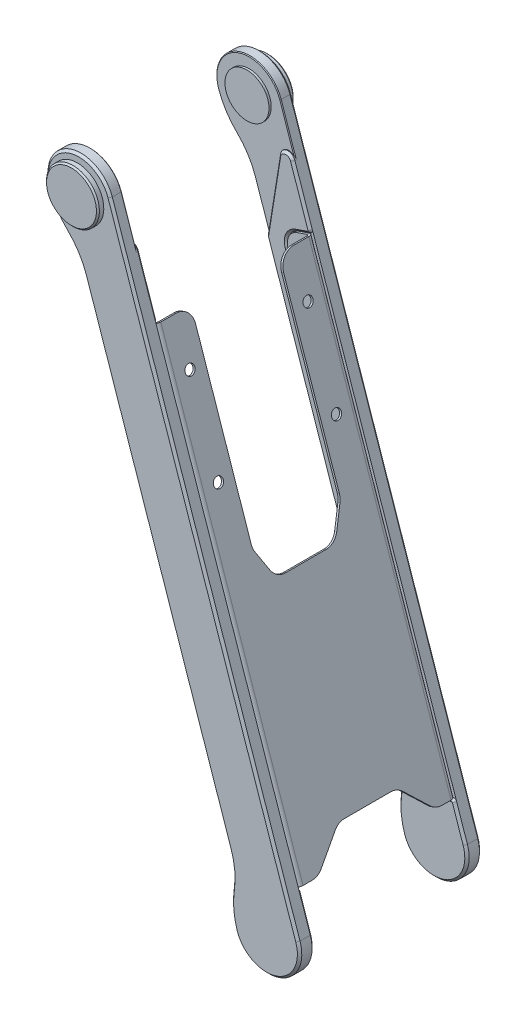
SolidWorks part; units mm, degrees
ref_plane "Front" through (0, 0, 0) normal (0, 0, 1) x (1, 0, 0)
ref_plane "Top" through (0, 0, 0) normal (0, 1, 0) x (1, 0, 0)
ref_plane "Right" through (0, 0, 0) normal (1, 0, 0) x (0, 0, -1)
imported_body "Defeature ausgeführt1"
imported_body "Defeature ausgeführt2"
imported_body "Defeature ausgeführt3"
imported_body "Defeature ausgeführt4"
imported_body "Defeature ausgeführt5"
imported_body "Defeature ausgeführt6"
imported_body "Defeature ausgeführt7"
imported_body "Defeature ausgeführt8"
imported_body "Defeature ausgeführt9"
other "Fläche löschen1"
other "Fläche löschen2"
other "Fläche löschen3"
other "Fläche löschen4"
other "Fläche löschen5"
other "Fläche löschen6"
other "Fläche löschen7"
sketch "Skizze1" plane through (201.687, 68.7685, 0) normal (0.9465, 0.3227, 0) x (0, 0, -1)
  line L0 (-40.2, -166.0648) -> (40.2, -166.0648) construction
  line L1 (40.2, -166.0648) -> (40.2, -226.0648) construction
  line L2 (40.2, -226.0648) -> (-40.2, -226.0648) construction
  line L3 (-40.2, -226.0648) -> (-40.2, -166.0648) construction
  line L4 (-50.4, -136.0648) -> (-40, -136.0648) construction
  line L5 (0, -286.0648) -> (0, -166.0648) construction
  line L6 (-13.8197, -286.0648) -> (13.8197, -286.0648) construction
  circle A0 centre (-40.2, -166.0648) radius 3.3
  circle A1 centre (-40.2, -226.0648) radius 3.3
  circle A2 centre (40.2, -166.0648) radius 3.3
  circle A3 centre (40.2, -226.0648) radius 3.3
  dimension "D1" = 6.6
  dimension "D2" = 60
  dimension "D3" = 30
  dimension "D4" = 80.4
extrude "Schnitt-Linear austragen1" cut sketch "Skizze1" against normal through all
